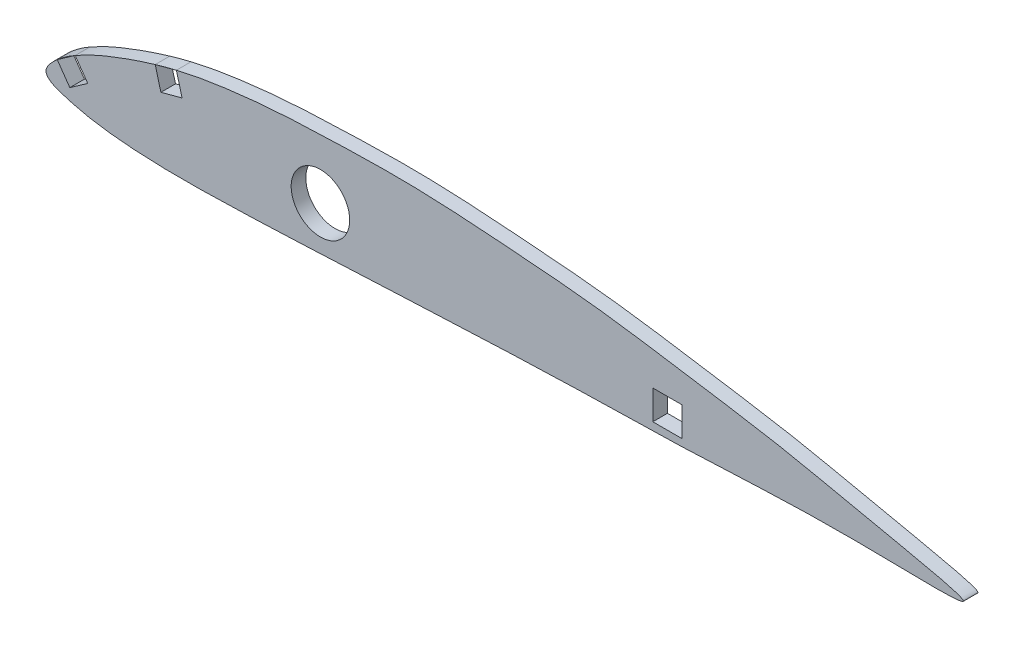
SolidWorks part; units mm, degrees
ref_plane "Front Plane" through (0, 0, 0) normal (0, 0, 1) x (1, 0, 0)
ref_plane "Top Plane" through (0, 0, 0) normal (0, 1, 0) x (1, 0, 0)
ref_plane "Right Plane" through (0, 0, 0) normal (1, 0, 0) x (0, 0, -1)
sketch3d "3DSketch1"
  spline S1 degree 3 poles (5.1592, -3.0638, 0) (-1.9063, -0.8378, 0) (2.2717, 3.4573, 0) (5.5762, 5.824, 0) (9.8591, 8.1303, 0) (18.0609, 11.4665, 0) (28.0102, 14.6409, 0) (39.7874, 16.5243, 0) (49.7692, 17.5204, 0) (63.056, 18.0773, 0) (79.6813, 18.5488, 0) (99.5793, 17.1523, 0) (119.621, 15.5907, 0) (139.2079, 12.453, 0) (160.2194, 9.2408, 0) (176.2546, 5.4685, 0) (210.3883, -1.2928, 0) (166.2228, 0.2628, 0) (147.0162, -1.4949, 0) (105.5544, -2.1485, 0) (73.1439, -3.9145, 0) (39.7743, -5.369, 0) (23.375, -5.6379, 0) (11.3043, -4.4689, 0) (5.1592, -3.0638, 0) (-1.9063, -0.8378, 0) (2.2717, 3.4573, 0) knots -0.051806 -0.027094 -0.014492 0 0.01056 0.018211 0.03221 0.045525 0.084069 0.108974 0.133649 0.158233 0.207343 0.256523 0.305826 0.355445 0.405214 0.45539 0.506007 0.555122 0.65337 0.70249 0.849939 0.899083 0.948194 0.972906 0.985508 1 1.01056 1.018211 1.03221 only from (0, 0, 0) to (0, 0, 0)
  dimension "D1" = 199.15
extrude "Boss-Extrude1" add sketch "3DSketch1" along direction (0, 0, 1) on the side of the normal blind 3.175
sketch "Sketch1" plane through (0, 0, 3.175) normal (0, 0, 1) x (1, 0, 0)
  line L0 (0, 0) -> (199.15, 0) construction
  line L1 (99.575, 0) -> (99.575, 5) construction
  line L2 (99.575, 5) -> (59.575, 5) construction
  line L3 (2.4378, 3.4404) -> (6.339, 6.172)
  line L4 (131.732, 6.35) -> (138.082, 6.35)
  line L5 (131.732, 6.35) -> (131.732, 0)
  line L6 (131.732, 0) -> (138.082, 0)
  line L7 (138.082, 6.35) -> (138.082, 0)
  line L8 (2.4378, 3.4404) -> (5.1694, -0.4608)
  line L9 (6.339, 6.172) -> (9.0706, 2.2708)
  line L10 (5.1694, -0.4608) -> (9.0706, 2.2708)
  line L11 (23.7054, 13.1425) -> (28.3056, 14.3752)
  line L12 (23.7054, 13.1425) -> (24.938, 8.5423)
  line L13 (28.3056, 14.3752) -> (29.5382, 9.775)
  line L14 (24.938, 8.5423) -> (29.5382, 9.775)
  circle A0 centre (59.575, 5) radius 6.35
  spline S0 degree 3 poles (2.2717, 3.4573) (-1.9063, -0.8378) (5.1592, -3.0638) (11.3043, -4.4689) (23.375, -5.6379) (39.7743, -5.369) (73.1439, -3.9145) (105.5544, -2.1485) (147.0162, -1.4949) (166.2228, 0.2628) (210.3883, -1.2928) (176.2546, 5.4685) (160.2194, 9.2408) (139.2079, 12.453) (119.621, 15.5907) (99.5793, 17.1523) (79.6813, 18.5488) (63.056, 18.0773) (49.7692, 17.5204) (39.7874, 16.5243) (28.0102, 14.6409) (18.0609, 11.4665) (9.8591, 8.1303) (5.5762, 5.824) (2.2717, 3.4573) (-1.9063, -0.8378) (5.1592, -3.0638) knots -0.03221 -0.018211 -0.01056 0 0.014492 0.027094 0.051806 0.100917 0.150061 0.29751 0.34663 0.444878 0.493993 0.54461 0.594786 0.644555 0.694174 0.743477 0.792657 0.841767 0.866351 0.891026 0.915931 0.954475 0.96779 0.981789 0.98944 1 1.014492 1.027094 1.051806 only from (0, 0) to (0, 0) construction
  dimension "D3" = 32.157
  dimension "D1" = 5
  dimension "D2" = 40
  dimension "D4" = 6.35
  dimension "D5" = 6.35
  dimension "D6" = 4.7625
  dimension "D7" = 4.7625
  dimension "D8" = 55
  dimension "D9" = 4.7625
  dimension "D10" = 4.7625
  dimension "D11" = 75
extrude "Cut-Extrude1" cut sketch "Sketch1" against normal blind 10
